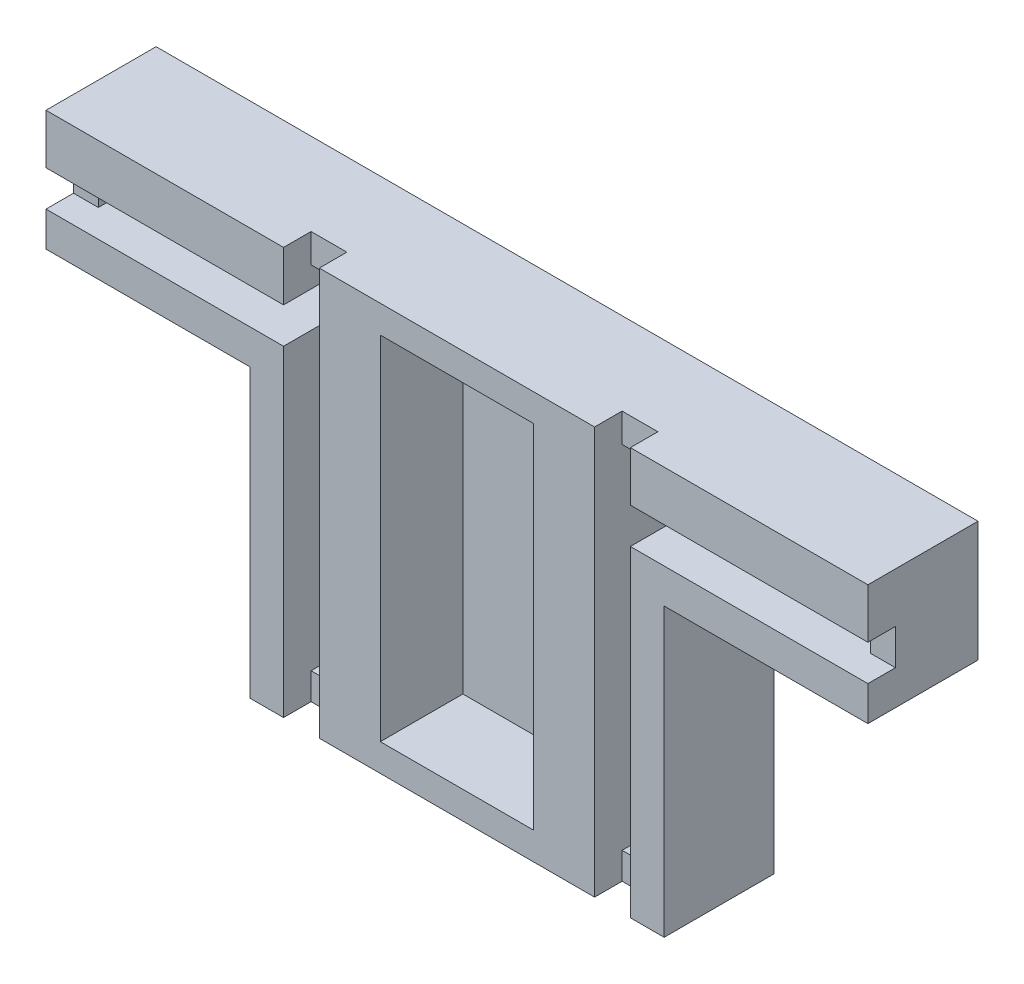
SolidWorks part; units mm, degrees
ref_plane "Front" through (0, 0, 0) normal (0, 0, 1) x (1, 0, 0)
ref_plane "Top" through (0, 0, 0) normal (0, 1, 0) x (1, 0, 0)
ref_plane "Right" through (0, 0, 0) normal (1, 0, 0) x (0, 0, -1)
sketch "Sketch1" plane through (0, 0, 0) normal (0, 0, 1) x (1, 0, 0)
  line L1 (0, 0) -> (149.3, 0)
  line L2 (0, 0) -> (0, 73.97)
  line L3 (0, 73.97) -> (149.3, 73.97)
  line L4 (149.3, 0) -> (149.3, 73.97)
  dimension "D1" = 73.97
  dimension "D2" = 149.3
extrude "Boss-Extrude1" add sketch "Sketch1" along normal blind 20
sketch "Sketch2" plane through (0, 0, 20) normal (0, 0, 1) x (1, 0, 0)
  line L1 (4.5, 64.92) -> (43.15, 64.92)
  line L2 (4.5, 64.92) -> (4.5, 58.42)
  line L3 (4.5, 58.42) -> (43.15, 58.42)
  line L4 (43.15, 64.92) -> (43.15, 58.42)
  line L5 (49.65, 68.72) -> (43.15, 68.72)
  line L6 (49.65, 68.72) -> (49.65, 4.87)
  line L7 (49.65, 4.87) -> (43.15, 4.87)
  line L8 (43.15, 68.72) -> (43.15, 4.87)
  line L9 (0, 73.97) -> (0, 0) construction
  line L10 (149.3, 73.97) -> (0, 73.97) construction
  line L11 (74.65, 0) -> (74.65, 93.9021) construction
  line L12 (147.8797, 67.9997) -> (147.8797, 55.3403)
  line L13 (96.5703, 1.7903) -> (109.2297, 1.7903)
  line L14 (99.65, 4.87) -> (106.15, 4.87)
  line L15 (144.8, 64.92) -> (106.15, 64.92)
  line L16 (144.8, 64.92) -> (144.8, 58.42)
  line L17 (104.9, -50.38) -> (-12.1, -50.38)
  line L18 (103.0703, 67.9997) -> (103.0703, 55.3403)
  line L19 (147.8797, 67.9997) -> (103.0703, 67.9997)
  line L20 (1.4203, 67.9997) -> (46.2297, 67.9997)
  line L21 (46.2297, 67.9997) -> (46.2297, 55.3403)
  line L22 (1.4203, 55.3403) -> (46.2297, 55.3403)
  line L23 (1.4203, 67.9997) -> (1.4203, 55.3403)
  line L24 (40.0703, 71.7997) -> (40.0703, 1.7903)
  line L25 (52.7297, 1.7903) -> (40.0703, 1.7903)
  line L26 (52.7297, 71.7997) -> (52.7297, 1.7903)
  line L27 (52.7297, 71.7997) -> (40.0703, 71.7997)
  line L28 (0, 0) -> (149.3, 0) construction
  line L29 (144.8, 58.42) -> (106.15, 58.42)
  line L30 (104.9, 123.97) -> (-12.1, 123.97) construction
  line L31 (147.8797, 55.3403) -> (103.0703, 55.3403)
  line L32 (109.2297, 71.7997) -> (109.2297, 1.7903)
  line L33 (104.9, 123.97) -> (104.9, -50.38) construction
  line L34 (96.5703, 71.7997) -> (109.2297, 71.7997)
  line L35 (-12.1, 123.97) -> (-12.1, -50.38) construction
  line L36 (96.5703, 71.7997) -> (96.5703, 1.7903)
  line L37 (106.15, 68.72) -> (106.15, 4.87)
  line L38 (99.65, 68.72) -> (106.15, 68.72)
  line L39 (99.65, 68.72) -> (99.65, 4.87)
  line L41 (88.5703, 5) -> (60.7297, 5)
  line L42 (88.5703, 5) -> (88.5703, 68.97)
  line L43 (88.5703, 68.97) -> (60.7297, 68.97)
  line L44 (60.7297, 5) -> (60.7297, 68.97)
  dimension "D1" = 6.5
  dimension "D2" = 6.5
  dimension "D3" = 38.65
  dimension "D4" = 4.5
  dimension "D5" = 5.25
  dimension "D6" = 63.85
  dimension "D7" = 3.8
  dimension "D10" = 8
  dimension "D11" = 8
  dimension "D12" = 5
  dimension "D13" = 5
  dimension "D8" = 55.25
  dimension "D9" = 3.0797
extrude "Cut-Extrude1" cut sketch "Sketch2" against normal blind 15
sketch "Sketch3" plane through (0, 0, 20) normal (0, 0, 1) x (1, 0, 0)
  line L0 (74.65, 0) -> (74.65, 84.7848) construction
  line L1 (0, 0) -> (37.0146, 0)
  line L2 (0, 0) -> (0, 52.1212)
  line L3 (0, 52.1212) -> (37.0146, 52.1212)
  line L4 (37.0146, 0) -> (37.0146, 52.1212)
  line L5 (0, 0) -> (149.3, 0) construction
  line L6 (149.3, 0) -> (112.2854, 0)
  line L7 (149.3, 0) -> (149.3, 52.1212)
  line L8 (149.3, 52.1212) -> (112.2854, 52.1212)
  line L9 (112.2854, 0) -> (112.2854, 52.1212)
extrude "Cut-Extrude2" cut sketch "Sketch3" against normal blind 20
ref_plane "Plane1" through (74.65, 0, 0) normal (-1, 0, 0) x (0, 0, 1)
sketch "Sketch6" plane through (0, 0, 20) normal (0, 0, 1) x (1, 0, 0)
  line L0 (149.3, 52.1212) -> (149.3, 73.97) construction
  line L1 (144.8, 58.42) -> (149.3, 58.42)
  line L2 (144.8, 58.42) -> (144.8, 64.92)
  line L3 (144.8, 64.92) -> (149.3, 64.92)
  line L4 (149.3, 58.42) -> (149.3, 64.92)
  line L5 (37.0146, 0) -> (112.2854, 0) construction
  line L6 (106.15, 4.87) -> (99.65, 4.87)
  line L7 (106.15, 4.87) -> (106.15, 0)
  line L8 (106.15, 0) -> (99.65, 0)
  line L9 (99.65, 4.87) -> (99.65, 0)
  line L10 (0, 73.97) -> (0, 52.1212) construction
  line L11 (49.65, 4.87) -> (43.15, 4.87)
  line L12 (49.65, 4.87) -> (49.65, 0)
  line L13 (49.65, 0) -> (43.15, 0)
  line L14 (43.15, 4.87) -> (43.15, 0)
  line L15 (4.5, 58.42) -> (0, 58.42)
  line L16 (4.5, 58.42) -> (4.5, 64.92)
  line L17 (4.5, 64.92) -> (0, 64.92)
  line L18 (0, 58.42) -> (0, 64.92)
  line L19 (149.3, 73.97) -> (0, 73.97) construction
  line L20 (43.15, 68.72) -> (49.65, 68.72)
  line L21 (43.15, 68.72) -> (43.15, 73.97)
  line L22 (43.15, 73.97) -> (49.65, 73.97)
  line L23 (49.65, 68.72) -> (49.65, 73.97)
  line L25 (99.65, 68.72) -> (106.15, 68.72)
  line L26 (99.65, 68.72) -> (99.65, 73.97)
  line L27 (99.65, 73.97) -> (106.15, 73.97)
  line L28 (106.15, 68.72) -> (106.15, 73.97)
  dimension "D1" = 6.5
  dimension "D2" = 6.5
  dimension "D3" = 6.5
  dimension "D4" = 6.5
  dimension "D5" = 6.5
  dimension "D6" = 6.5
extrude "Cut-Extrude3" cut sketch "Sketch6" against normal blind 5
